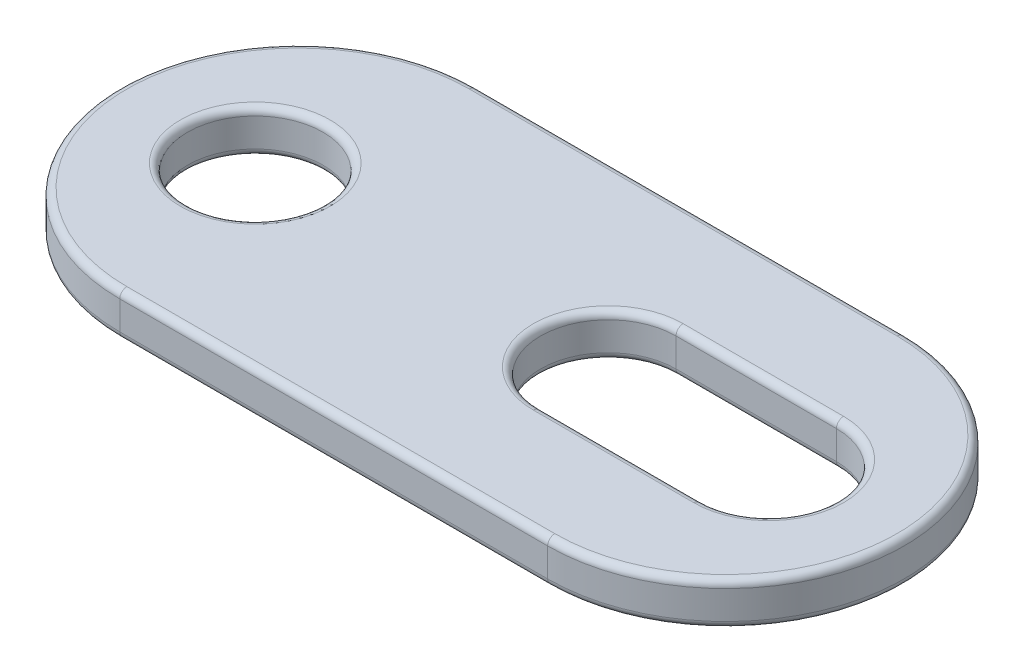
SolidWorks part; units mm, degrees
ref_plane "Front" through (0, 0, 0) normal (0, 0, 1) x (1, 0, 0)
ref_plane "Top" through (0, 0, 0) normal (0, 1, 0) x (1, 0, 0)
ref_plane "Right" through (0, 0, 0) normal (1, 0, 0) x (0, 0, -1)
sketch "Sketch1" plane through (0, 0, 0) normal (0, 1, 0) x (1, 0, 0)
  line L1 (0, 0) -> (15.24, 0)
  line L2 (11.049, 8.763) -> (16.764, 8.763)
  line L3 (0, 12.7) -> (15.24, 12.7)
  line L5 (11.049, 3.937) -> (16.764, 3.937)
  arc A0 (0, 12.7) -> (0, 0) centre (0, 6.35) ccw
  arc A1 (15.24, 0) -> (15.24, 12.7) centre (15.24, 6.35) ccw
  circle A2 centre (-1.524, 6.35) radius 2.413
  arc A3 (11.049, 8.763) -> (11.049, 3.937) centre (11.049, 6.35) ccw
  arc A4 (16.764, 3.937) -> (16.764, 8.763) centre (16.764, 6.35) ccw
  dimension "D3" = 4.826
  dimension "D1" = 12.7
  dimension "D2" = 15.24
  dimension "D4" = 1.524
  dimension "D5" = 4.826
  dimension "D6" = 2.413
  dimension "D7" = 1.524
  dimension "D8" = 5.715
sheet metal parameters "Sheet-Metal1" thickness 1.524 parameters "D1"=3.81
base flange "Base-Flange1" sketch "Sketch1" thickness 1.524 reverse thickness direction yes parameters "D1"=3.81
fillet "Fillet2" radius 0.254 18 edges at (13.9065, 0, -8.763) (19.177, 0, -6.35) (13.9065, 0, -3.937) (8.636, 0, -6.35) (7.62, 0, 0) (21.59, 0, -6.35) (7.62, 0, -12.7) (-6.35, 0, -6.35) (-1.524, 0, -3.937) (19.177, 1.524, -6.35) (13.9065, 1.524, -8.763) (8.636, 1.524, -6.35) (13.9065, 1.524, -3.937) (7.62, 1.524, -12.7) (21.59, 1.524, -6.35) (7.62, 1.524, 0) (-6.35, 1.524, -6.35) (-1.524, 1.524, -3.937)
flat pattern "Flat-Pattern1"
sketch "Bend-Lines1" plane through (0, 0, 0) normal (0, 1, 0) x (-1, 0, 0)
